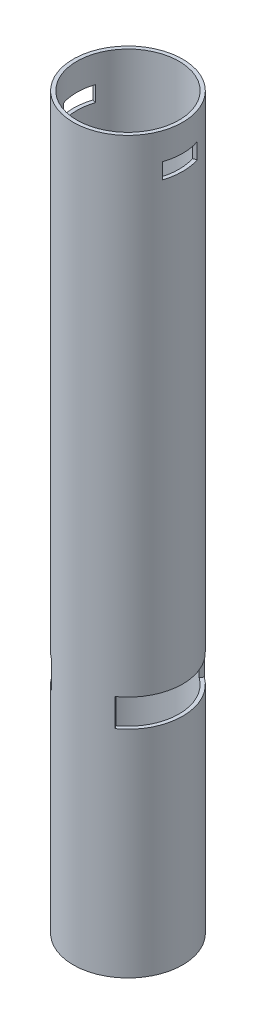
SolidWorks part; units mm, degrees
ref_plane "Plan de face" through (0, 0, 0) normal (0, 0, 1) x (1, 0, 0)
ref_plane "Plan de dessus" through (0, 0, 0) normal (0, 1, 0) x (1, 0, 0)
ref_plane "Plan de droite" through (0, 0, 0) normal (1, 0, 0) x (0, 0, -1)
sketch "Esquisse1" plane through (0, 0, 0) normal (0, 1, 0) x (1, 0, 0)
  circle A0 centre (0, 0) radius 157.5
  circle A1 centre (0, 0) radius 146.9
  dimension "D1" = 10.6
  dimension "D2" = 315
extrude "Boss.-Extru.1" add sketch "Esquisse1" along normal blind 2100
sketch "Esquisse2" plane through (0, 0, 0) normal (0, 0, 1) x (1, 0, 0)
  line L0 (157.5, 0) -> (157.5, 2100) construction
  line L1 (157.5, 700) -> (30, 700)
  line L2 (157.5, 700) -> (157.5, 620)
  line L3 (157.5, 620) -> (30, 620)
  line L4 (-157.5, 700) -> (-157.5, 620)
  line L5 (0, 700) -> (0, 620) construction
  line L6 (-157.5, 0) -> (157.5, 0) construction
  line L7 (-30, 700) -> (-30, 620)
  line L8 (30, 620) -> (30, 700)
  line L9 (-30, 700) -> (-157.5, 700)
  line L10 (-30, 620) -> (-157.5, 620)
  line L11 (-30, 700) -> (0, 700) construction
  line L12 (0, 700) -> (30, 700) construction
  line L13 (30, 620) -> (0, 620) construction
  line L14 (0, 620) -> (-30, 620) construction
  dimension "D1" = 80
  dimension "D2" = 315
  dimension "D3" = 620
  dimension "D4" = 60
  dimension "D5" = 30
revolve "Enlèvement de matière-Révolution18" cut sketch "Esquisse2" angle 54.565 about L5
sketch "Esquisse3" plane through (0, 0, 0) normal (0, 0, 1) x (1, 0, 0)
  line L0 (157.5, 700) -> (157.5, 2100) construction
  line L1 (-157.5, 2022.5) -> (-15.9565, 2022.5)
  line L2 (-157.5, 2022.5) -> (-157.5, 1977.5) construction
  line L3 (-157.5, 1977.5) -> (-15.9565, 1977.5)
  line L4 (157.5, 2022.5) -> (157.5, 1977.5) construction
  line L6 (-157.5, 2100) -> (-157.5, 700) construction
  line L7 (-0.9565, 2022.5) -> (-0.9565, 1977.5) construction
  line L8 (-15.9565, 2022.5) -> (-15.9565, 1977.5)
  line L9 (14.0435, 2022.5) -> (14.0435, 1977.5)
  line L10 (-157.5, 0) -> (157.5, 0) construction
  line L11 (14.0435, 2022.5) -> (157.5, 2022.5)
  line L12 (14.0435, 1977.5) -> (157.5, 1977.5)
  arc A0 (-157.5, 2022.5) -> (-157.5, 1977.5) centre (-159.967, 2000) ccw
  arc A1 (157.5, 2022.5) -> (157.5, 1977.5) centre (112.756, 2000) cw
  dimension "D1" = 45
  dimension "D2" = 1977.5
  dimension "D3" = 15
  dimension "D4" = 30
revolve "Enlèvement de matière-Révolution26" cut sketch "Esquisse3" angle 18.19 about L7
